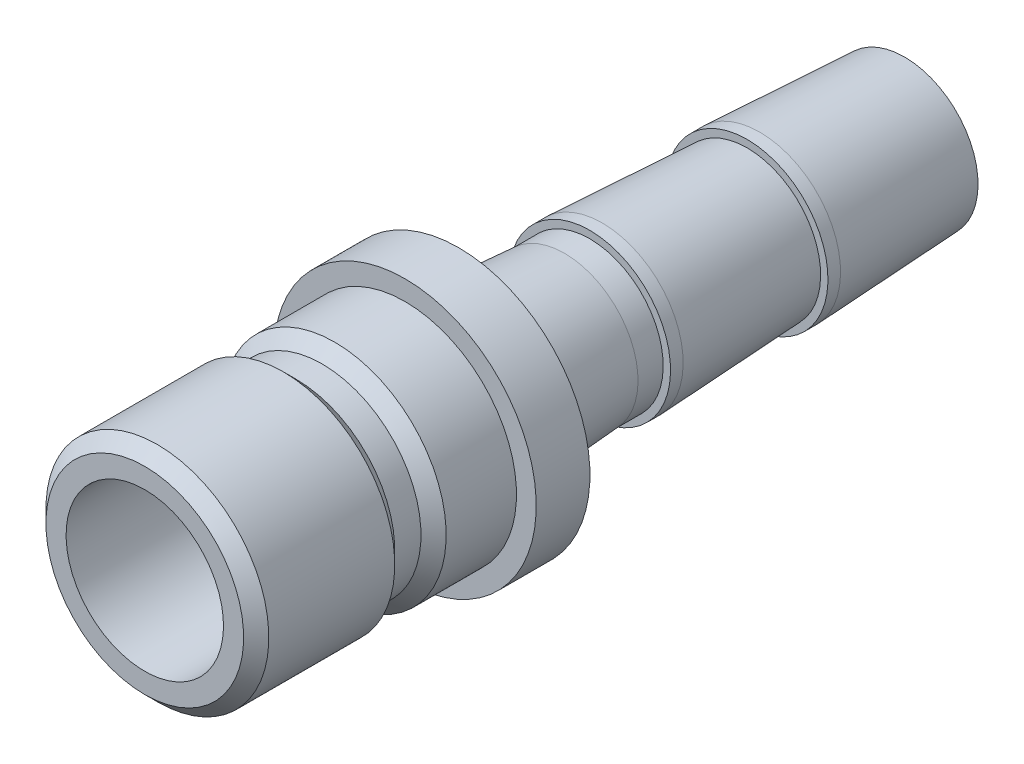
SolidWorks part; units mm, degrees
ref_plane "Front Plane" through (0, 0, 0) normal (0, 0, 1) x (1, 0, 0)
ref_plane "Top Plane" through (0, 0, 0) normal (0, 1, 0) x (1, 0, 0)
ref_plane "Right Plane" through (0, 0, 0) normal (1, 0, 0) x (0, 0, -1)
sketch "Sketch1" plane through (0, 0, 0) normal (1, 0, 0) x (0, 0, -1)
  line L0 (0, 0) -> (-18.923, 0) construction
  line L1 (-15.748, 4.7625) -> (-15.748, 5.9817)
  line L2 (-6.604, 5.9817) -> (-6.604, 0) construction
  line L3 (-14.986, 6.7437) -> (-7.366, 6.7437)
  line L4 (0, 7.9375) -> (0, 0) construction
  line L5 (-6.604, 5.9817) -> (-5.0165, 5.9817)
  line L6 (-4.2545, 6.7437) -> (0, 6.7437)
  line L7 (0, 6.7437) -> (0, 7.9375)
  line L8 (-6.604, 5.9817) -> (-7.366, 6.7437)
  line L9 (-5.0165, 5.9817) -> (-4.2545, 6.7437)
  line L10 (-15.748, 5.9817) -> (-14.986, 6.7437)
  line L11 (-15.748, 4.7625) -> (-3.556, 4.7625)
  line L12 (0, 7.9375) -> (3.2512, 7.9375)
  line L13 (21.463, 4.8895) -> (20.701, 4.8895)
  line L14 (30.226, 4.445) -> (30.226, 3.5719)
  line L15 (0, 0) -> (4.445, 0) construction
  line L16 (20.701, 4.8895) -> (20.701, 4.445)
  line L17 (-0.6919, 3.5719) -> (30.226, 3.5719)
  line L18 (-3.556, 4.7625) -> (-0.6919, 3.5719)
  line L19 (30.226, 4.445) -> (21.463, 4.8895)
  line L20 (11.938, 4.8895) -> (11.176, 4.8895)
  line L21 (20.701, 4.445) -> (11.938, 4.8895)
  line L23 (11.176, 4.445) -> (9.652, 4.445)
  line L24 (9.652, 4.445) -> (3.2512, 4.8895)
  line L25 (3.2512, 4.8895) -> (3.2512, 7.9375)
  line L26 (11.176, 4.8895) -> (11.176, 4.445)
  point P4 (17.526, 2.8442)
  point P14 (0, 0)
  dimension "D1" = 15.748
  dimension "D2" = 1.5875
  dimension "D3" = 0.762
  dimension "D4" = 45
  dimension "D5" = 9.144
  dimension "D6" = 45
  dimension "D7" = 15.875
  dimension "D8" = 26.9748
  dimension "D9" = 45.974
  dimension "D10" = 9.525
  dimension "D11" = 9.525
  dimension "D12" = 0.762
  dimension "D13" = 9.779
  dimension "D14" = 13.4874
  dimension "D15" = 7.1437
  dimension "D16" = 12.192
  dimension "D17" = 8.89
  dimension "D18" = 1.524
revolve "Revolve1" add sketch "Sketch1" angle 360 about L0
